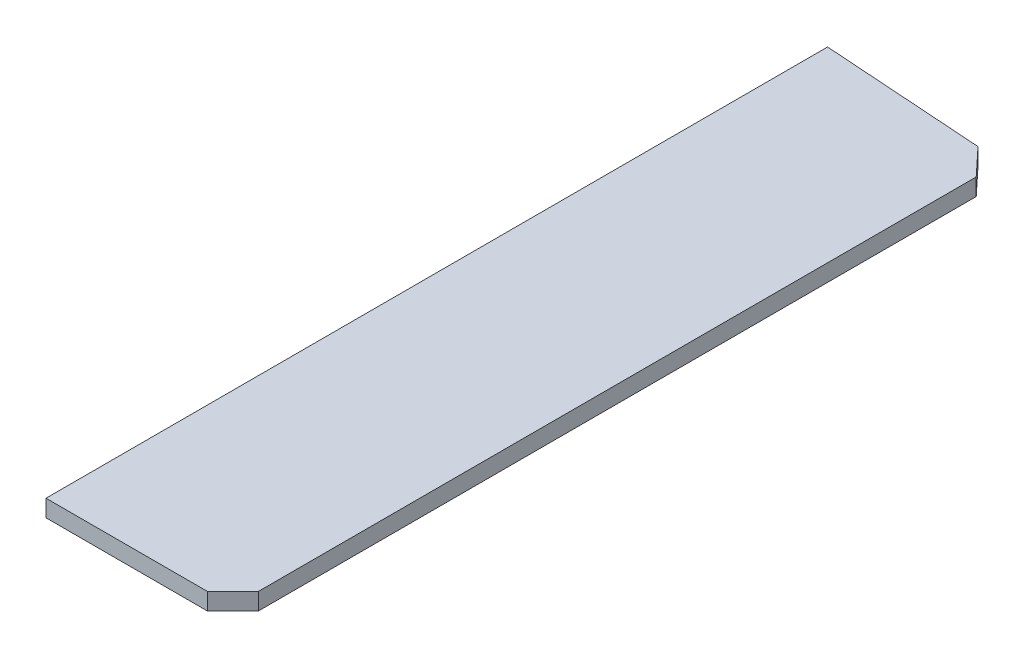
SolidWorks part; units mm, degrees
ref_plane "FRONT" through (0, 0, 0) normal (0, 0, 1) x (1, 0, 0)
ref_plane "TOP" through (0, 0, 0) normal (0, 1, 0) x (1, 0, 0)
ref_plane "RIGHT" through (0, 0, 0) normal (1, 0, 0) x (0, 0, -1)
sketch "Sketch1" plane through (0, 0, 0) normal (0, 1, 0) x (1, 0, 0)
  line L0 (0, 292.1) -> (60.3471, 287.9854)
  line L1 (60.3471, 287.9854) -> (69.85, 277.8125)
  line L2 (0, 292.1) -> (0, 0)
  line L3 (0, 0) -> (60.325, 0)
  line L4 (69.85, 277.8125) -> (69.85, 9.525)
  line L5 (60.325, 0) -> (69.85, 9.525)
  point P1 (69.85, 0)
  point P7 (69.85, 287.3375)
  dimension "D1" = 292.1
  dimension "D2" = 69.85
  dimension "D3" = 4.7625
extrude "Boss-Extrude1" add sketch "Sketch1" along normal blind 6.35
